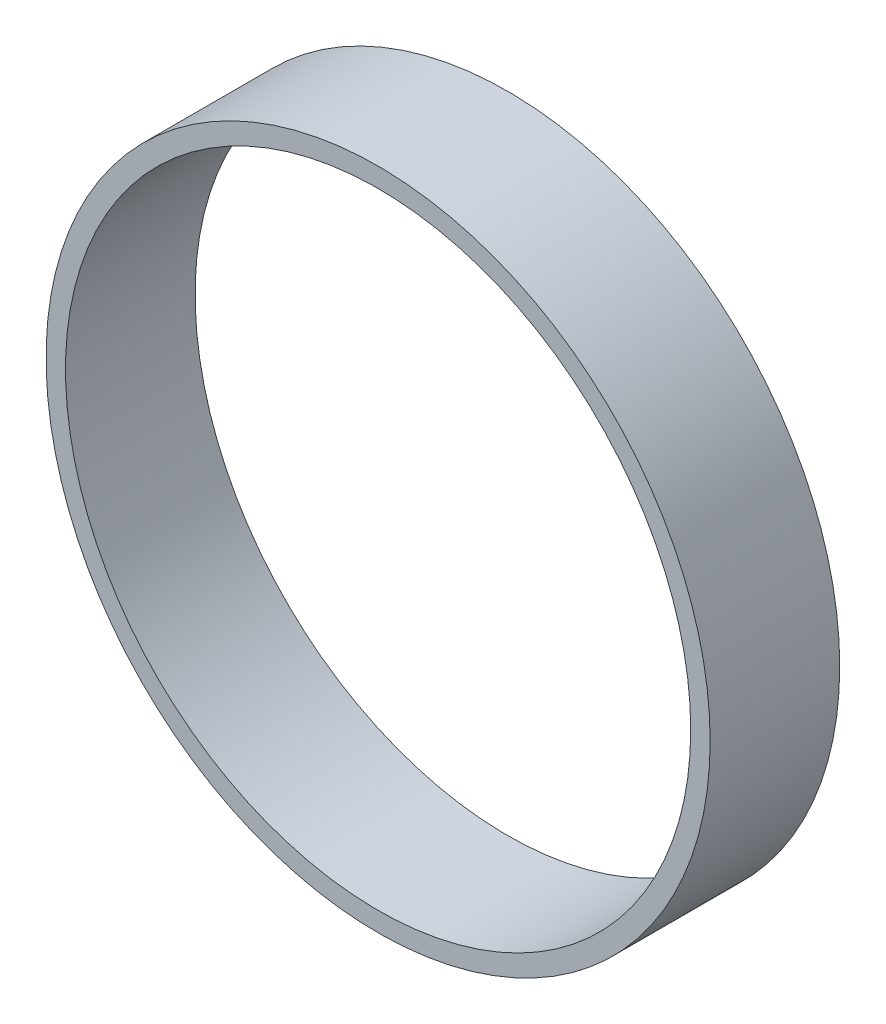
SolidWorks part; units mm, degrees
ref_plane "Front Plane" through (0, 0, 0) normal (0, 0, 1) x (1, 0, 0)
ref_plane "Top Plane" through (0, 0, 0) normal (0, 1, 0) x (1, 0, 0)
ref_plane "Right Plane" through (0, 0, 0) normal (1, 0, 0) x (0, 0, -1)
sketch "Sketch2" plane through (0, 0, 0) normal (0, 0, 1) x (1, 0, 0)
  circle A0 centre (0, 0) radius 26.035
  circle A1 centre (0, 0) radius 24.511
  dimension "D1" = 52.07
  dimension "D2" = 1.524
extrude "Boss-Extrude1" add sketch "Sketch2" against normal blind 10.16
